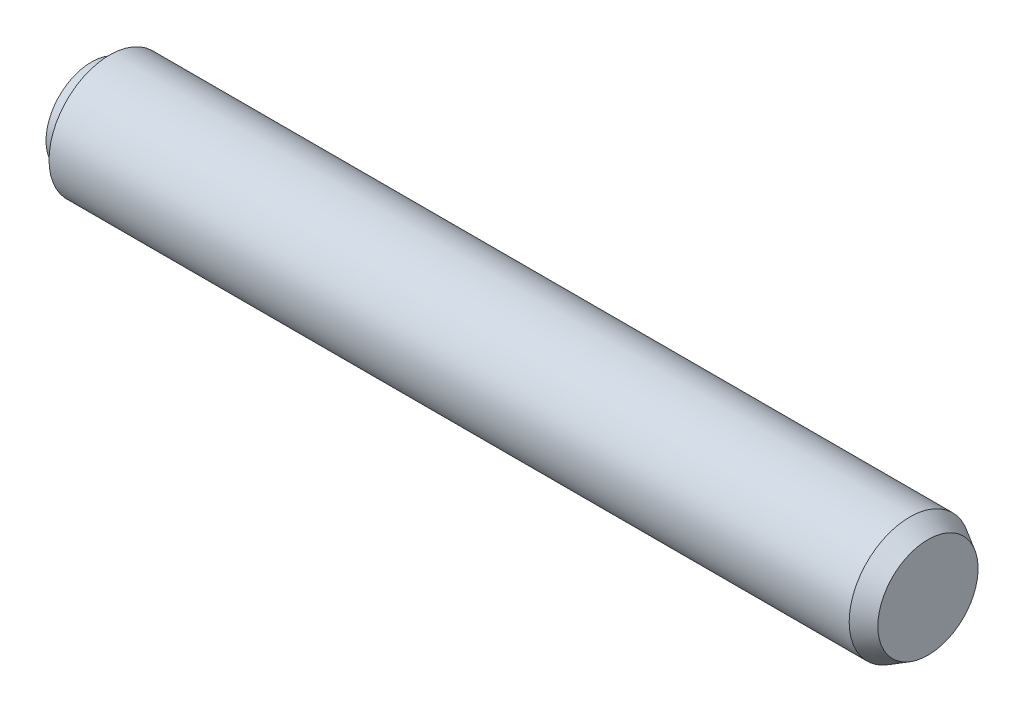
SolidWorks part; units mm, degrees
ref_plane "Face" through (0, 0, 0) normal (0, 0, 1) x (1, 0, 0)
ref_plane "Dessus" through (0, 0, 0) normal (0, 1, 0) x (1, 0, 0)
ref_plane "Droite" through (0, 0, 0) normal (1, 0, 0) x (0, 0, -1)
sketch "Esquisse1" plane through (0, 0, 0) normal (0, 0, 1) x (1, 0, 0)
  line L0 (0, 0) -> (129.3262, 0) construction
  line L1 (0, 0) -> (0, 7.5)
  line L2 (0, 7.5) -> (3, 7.5)
  line L3 (3, 7.5) -> (3, 10)
  line L4 (3, 10) -> (138, 10)
  line L5 (138, 10) -> (138, 0)
  line L6 (138, 0) -> (0, 0)
  dimension "D1" = 7.5
  dimension "D2" = 10
  dimension "D3" = 3
  dimension "D4" = 138
revolve "Révolution1" add sketch "Esquisse1" angle 360 about L0
chamfer "Chanfrein1" distance 3 angle 30 1 edges at (138, 0, 10)
